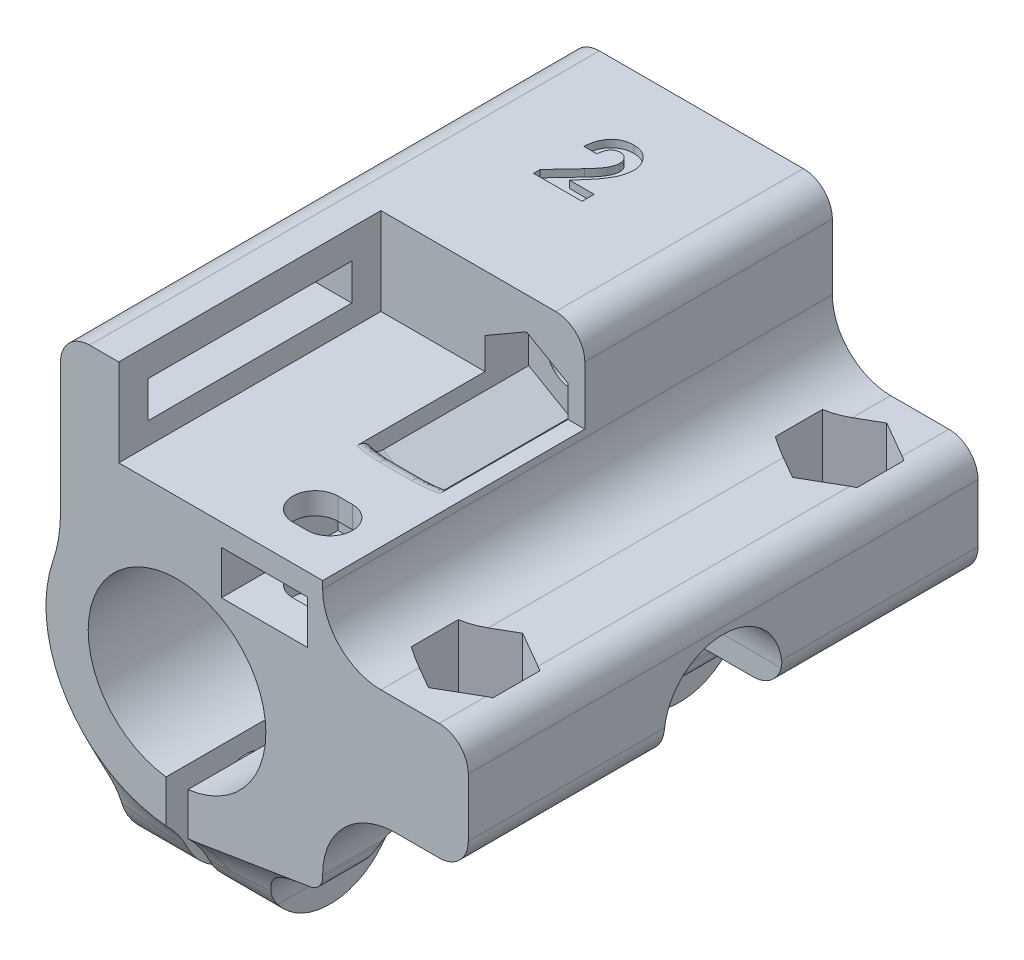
SolidWorks part; units mm, degrees
ref_plane "Спереди" through (0, 0, 0) normal (0, 0, 1) x (1, 0, 0)
ref_plane "Сверху" through (0, 0, 0) normal (0, 1, 0) x (1, 0, 0)
ref_plane "Справа" through (0, 0, 0) normal (1, 0, 0) x (0, 0, -1)
sketch "Эскиз1" plane through (0, 0, 0) normal (0, 0, 1) x (1, 0, 0)
  line L0 (0, 0) -> (0, 21.6321) construction
  line L1 (0, 0) -> (26.3176, 0) construction
  line L2 (10, -1.5) -> (10, -7.5)
  line L3 (-8, 15) -> (-8, 6.0828)
  line L4 (-6, 17) -> (8, 17)
  line L5 (10, 15) -> (10, 6.5)
  line L6 (10, -7.5) -> (1.4365, -8.8846)
  line L8 (10, 6.5) -> (18, 6.5)
  line L9 (20, 4.5) -> (20, 0.5)
  line L10 (18, -1.5) -> (10, -1.5)
  arc A0 (-8.5263, 2.8813) -> (-8, 6.0828) centre (-18, 6.0828) ccw
  arc A1 (-8.5263, 2.8813) -> (1.4365, -8.8846) centre (0, 0) ccw
  arc A2 (20, 0.5) -> (18, -1.5) centre (18, 0.5) cw
  arc A3 (18, 6.5) -> (20, 4.5) centre (18, 4.5) cw
  arc A6 (8, 17) -> (10, 15) centre (8, 15) cw
  arc A7 (-6, 17) -> (-8, 15) centre (-6, 15) ccw
  point P16 (20, 6.5)
  point P30 (20, -1.5)
  dimension "D2" = 1.5
  dimension "D4" = 2
  dimension "D5" = 6
  dimension "D6" = 9
  dimension "D12" = 2
  dimension "D13" = 10
  dimension "D3" = 20
  dimension "D7" = 17
  dimension "D8" = 8
  dimension "D9" = 10
  dimension "D14" = 8
extrude "Бобышка-Вытянуть1" add sketch "Эскиз1" along normal blind 35
fillet "Скругление21" radius 5 1 edges at (10, -1.5, 17.5)
fillet "Скругление24" radius 4 1 edges at (10, 6.5, 17.5)
sketch "Эскиз2" plane through (20, 0, 0) normal (1, 0, 0) x (0, 0, -1)
  line L1 (-35, 0.5) -> (-35, -1.5) construction
  line L3 (-21.55, 0) -> (-21.55, -7.076)
  line L5 (0, 0) -> (-35, 0) construction
  line L8 (-21.55, -7.076) -> (-13.45, -7.076)
  line L9 (-13.45, -7.076) -> (-13.45, 0)
  arc A0 (-13.45, 0) -> (-21.55, 0) centre (-17.5, 0) ccw
  dimension "D1" = 8.1
extrude "Вырез-Вытянуть1" cut sketch "Эскиз2" against normal blind 10
sketch "Эскиз3" plane through (0, 0, 35) normal (0, 0, 1) x (1, 0, 0)
  line L0 (10, 15) -> (10, 11)
  line L3 (10, 11) -> (-4, 11)
  line L4 (-4, 17) -> (-4, 11)
  line L5 (8, 17) -> (-6, 17) construction
  line L6 (-4, 17) -> (8, 17)
  line L7 (10, 10.5) -> (10, 15) construction
  line L10 (0, 0) -> (0, 11.8) construction
  arc A1 (10, 15) -> (8, 17) centre (8, 15) ccw construction
  arc A2 (10, 15) -> (8, 17) centre (8, 15) ccw
  dimension "D1" = 14
  dimension "D3" = 11
extrude "Вырез-Вытянуть2" cut sketch "Эскиз3" against normal blind 18
sketch "Эскиз5" plane through (0, 0, 0) normal (0, 0, -1) x (-1, 0, 0)
  line L0 (0, 0) -> (0, 21.6564) construction
  line L1 (-7.2, 15.7) -> (3.6, 15.7)
  line L2 (-8.2, 14.7) -> (-8.2, 8.3)
  line L3 (-7.2, 7.3) -> (3.6, 7.3)
  line L4 (4.6, 14.7) -> (4.6, 8.3)
  line L6 (-8.2, 11.5) -> (4.6, 11.5) construction
  arc A0 (3.6, 15.7) -> (4.6, 14.7) centre (3.6, 14.7) cw
  arc A1 (3.6, 7.3) -> (4.6, 8.3) centre (3.6, 8.3) ccw
  arc A2 (-8.2, 8.3) -> (-7.2, 7.3) centre (-7.2, 8.3) ccw
  arc A3 (-7.2, 15.7) -> (-8.2, 14.7) centre (-7.2, 14.7) ccw
  point P6 (4.6, 15.7)
  point P13 (-8.2, 15.7)
  dimension "D2" = 1
  dimension "D1" = 12.8
  dimension "D3" = 8.4
  dimension "D4" = 11.5
  dimension "D5" = 8.2
extrude "Вырез-Вытянуть4" cut sketch "Эскиз5" against normal blind 12
fillet "Скругление22" radius 1 1 edges at (10, -7.5, 17.5)
ref_plane "Плоскость2" [suppressed] through (0, 0, 25) normal (0, 0, 1) x (1, 0, 0)
sketch "Эскиз6" plane through (0, 0, 25) normal (0, 0, -1) x (-1, 0, 0)
  line L0 (-7, 11.5) -> (4.6, 11.5) construction
  line L2 (4.6, 8.3) -> (4.6, 14.7) construction
  line L3 (0, 0) -> (0, 20.3496) construction
  circle A0 centre (-6, 11.5) radius 1.55
  dimension "D1" = 3.1
  dimension "D2" = 6
extrude "Вырез-Вытянуть5" cut sketch "Эскиз6" along normal through all
sketch "Эскиз7" plane through (0, 0, 25) normal (0, 0, 1) x (1, 0, 0)
  line L1 (6, 8.2091) -> (8.85, 9.8546)
  line L2 (8.85, 9.8546) -> (8.85, 13.1454)
  line L3 (8.85, 13.1454) -> (6, 14.7909)
  line L4 (6, 14.7909) -> (3.15, 13.1454)
  line L5 (3.15, 13.1454) -> (3.15, 9.8546)
  line L6 (3.15, 9.8546) -> (6, 8.2091)
  circle A0 centre (6, 11.5) radius 2.85 construction
  dimension "D1" = 5.7
extrude "Вырез-Вытянуть6" cut sketch "Эскиз7" against normal blind 11
sketch "Эскиз9" plane through (0, 17, 0) normal (0, 1, 0) x (1, 0, 0)
  line L0 (-6, -17.5) -> (20, -17.5) construction
  line L1 (8, 0) -> (-6, 0) construction
  line L3 (0, 0) -> (0, -35) construction
  line L4 (-4, -35) -> (-6, -35) construction
  circle A0 centre (15.5, -5) radius 1.55
  circle A1 centre (15.5, -30) radius 1.55
  dimension "D1" = 3.1
  dimension "D3" = 15.5
  dimension "D2" = 25
  dimension "D4" = 17.5
extrude "Вырез-Вытянуть8" cut sketch "Эскиз9" against normal through all
sketch "Эскиз10" plane through (0, 17, 0) normal (0, -1, 0) x (1, 0, 0)
  line L0 (-9, 17.5) -> (23.6847, 17.5) construction
  line L1 (12.7, 28.3834) -> (15.5, 26.7668)
  line L2 (15.5, 26.7668) -> (18.3, 28.3834)
  line L3 (18.3, 28.3834) -> (18.3, 31.6166)
  line L4 (18.3, 31.6166) -> (15.5, 33.2332)
  line L5 (15.5, 33.2332) -> (12.7, 31.6166)
  line L6 (12.7, 31.6166) -> (12.7, 28.3834)
  line L7 (-9, 35) -> (-9, 0) construction
  line L8 (12.7, 3.3834) -> (12.7, 6.6166)
  line L9 (15.5, 1.7668) -> (12.7, 3.3834)
  line L10 (18.3, 3.3834) -> (15.5, 1.7668)
  line L11 (18.3, 6.6166) -> (18.3, 3.3834)
  line L12 (15.5, 8.2332) -> (18.3, 6.6166)
  line L13 (12.7, 6.6166) -> (15.5, 8.2332)
  circle A0 centre (15.5, 30) radius 2.8 construction
  circle A1 centre (15.5, 5) radius 2.8 construction
  dimension "D1" = 5.6
extrude "Вырез-Вытянуть9" cut sketch "Эскиз10" along normal blind 15
sketch "Эскиз13" plane through (0, 0, 0) normal (0, 0, -1) x (-1, 0, 0)
  circle A0 centre (-6, 11.5) radius 2.85
  dimension "D1" = 5.7
extrude "Вырез-Вытянуть10" cut sketch "Эскиз13" against normal up to surface (12 mm away)
fillet "Скругление3" radius 1 2 edges at (8.2, 13.3118, 6) (8.2, 9.6882, 6)
sketch "Эскиз16" plane through (0, 0, 0) normal (1, 0, 0) x (0, 0, -1)
  line L0 (0, 0) -> (-35, 0) construction
  line L1 (-17.5, 0) -> (-17.5, 5.7469) construction
  line L2 (-35, -9) -> (0, -9) construction
  line L4 (-35, 0.5) -> (-35, -1.5) construction
  circle A0 centre (-29.5, -9) radius 1.55 construction
  circle A1 centre (-29.5, -9) radius 4.5
  circle A2 centre (-5.5, -9) radius 4.5
  circle A3 centre (-17.5, 0) radius 4.05 construction
  dimension "D1" = 3.1
  dimension "D2" = 24
  dimension "D3" = 9
extrude "Бобышка-Вытянуть4" add sketch "Эскиз16" along normal mid plane 10
fillet "Скругление7" radius 7 4 edges at (-2.517, -8.6409, 9.9856) (-2.973, -8.4948, 25.0284) (3.2234, -8.5957, 25.0182) (3.2234, -8.5957, 9.9818)
fillet "Скругление9" radius 7 4 edges at (-1.5846, -8.8594, 33.9978) (-2.973, -8.4948, 1.0284) (3.2234, -8.5957, 1.0182) (3.2234, -8.5957, 33.9818)
fillet "Скругление11" radius 5 2 edges at (-5, -7.4833, 26.9178) (-5, -7.4833, 8.0822)
fillet "Скругление23" radius 4 2 edges at (5, -8.3084, 7.5868) (5, -8.3084, 27.4132)
sketch "Эскиз15" plane through (0, 0, 35) normal (0, 0, 1) x (1, 0, 0)
  circle A0 centre (0, 0) radius 6.1
  dimension "D1" = 12.2
extrude "Вырез-Вытянуть11" cut sketch "Эскиз15" against normal through all
sketch "Эскиз18" plane through (0, 0, 35) normal (0, 0, 1) x (1, 0, 0)
  line L0 (-5, -13.5) -> (5, -13.5) construction
  line L1 (-0.75, 0) -> (0.75, 0)
  line L2 (-0.75, 0) -> (-0.75, -13.5)
  line L3 (-0.75, -13.5) -> (0.75, -13.5)
  line L4 (0.75, 0) -> (0.75, -13.5)
  point P6 (0, 0)
  dimension "D1" = 1.5
extrude "Вырез-Вытянуть13" cut sketch "Эскиз18" against normal through all
ref_plane "Плоскость1" through (-10, 0, 0) normal (1, 0, 0) x (0, 0, -1)
sketch "Эскиз17" plane through (20, 0, 0) normal (1, 0, 0) x (0, 0, -1)
  line L0 (-17.5, -8.9687) -> (-17.5, 18.0703) construction
  line L1 (-20.3334, -8.9687) -> (-14.6666, -8.9687) construction
  circle A0 centre (-29.5, -9) radius 1.575
  circle A1 centre (-5.5, -9) radius 1.575
  dimension "D1" = 3.15
extrude "Вырез-Вытянуть12" cut sketch "Эскиз17" against normal through all
sketch "Эскиз19" plane through (-10, 0, 0) normal (1, 0, 0) x (0, 0, -1)
  line L0 (-17.5, -8.9687) -> (-17.5, 18.2144) construction
  line L1 (-32.7332, -9) -> (-31.1166, -11.8)
  line L2 (-31.1166, -11.8) -> (-27.8834, -11.8)
  line L3 (-27.8834, -11.8) -> (-26.2668, -9)
  line L4 (-26.2668, -9) -> (-27.8834, -6.2)
  line L5 (-27.8834, -6.2) -> (-31.1166, -6.2)
  line L6 (-31.1166, -6.2) -> (-32.7332, -9)
  line L7 (-14.6666, -8.9687) -> (-20.3334, -8.9687) construction
  line L8 (-3.8834, -6.2) -> (-2.2668, -9)
  line L9 (-7.1166, -6.2) -> (-3.8834, -6.2)
  line L10 (-8.7332, -9) -> (-7.1166, -6.2)
  line L11 (-7.1166, -11.8) -> (-8.7332, -9)
  line L12 (-3.8834, -11.8) -> (-7.1166, -11.8)
  line L13 (-2.2668, -9) -> (-3.8834, -11.8)
  circle A0 centre (-29.5, -9) radius 2.8 construction
  circle A1 centre (-5.5, -9) radius 2.8 construction
  dimension "D1" = 5.6
extrude "Вырез-Вытянуть14" cut sketch "Эскиз19" along normal blind 7
sketch "Эскиз24" plane through (20, 0, 0) normal (1, 0, 0) x (0, 0, -1)
  circle A0 centre (-29.5, -9) radius 2.85
  circle A1 centre (-5.5, -9) radius 2.85
  dimension "D1" = 5.7
extrude "Вырез-Вытянуть18" cut sketch "Эскиз24" against normal blind 16
sketch "Эскиз27" plane through (-4, 0, 0) normal (1, 0, 0) x (0, 0, -1)
  line L0 (-35, 17) -> (-35, 11) construction
  line L1 (-33, 15) -> (-19, 15)
  line L2 (-33, 15) -> (-33, 12.5)
  line L3 (-33, 12.5) -> (-19, 12.5)
  line L4 (-19, 15) -> (-19, 12.5)
  line L5 (-17, 17) -> (-17, 11) construction
  line L6 (-17, 17) -> (-35, 17) construction
  dimension "D1" = 2
  dimension "D2" = 2
  dimension "D3" = 2
  dimension "D4" = 2.5
sketch "Эскиз28" plane through (0, 0, 35) normal (0, 0, 1) x (1, 0, 0)
  line L0 (6, 11.5) -> (6, -14.6324) construction
  line L1 (-4, 11) -> (10, 11) construction
  line L2 (3.05, 9.5) -> (8.95, 9.5)
  line L3 (3.05, 9.5) -> (3.05, 6.5)
  line L4 (3.05, 6.5) -> (8.95, 6.5)
  line L5 (8.95, 9.5) -> (8.95, 6.5)
  point P7 (6, 9.5)
  dimension "D1" = 5.9
  dimension "D2" = 3
  dimension "D3" = 1.5
extrude "Вырез-Вытянуть20" cut sketch "Эскиз28" against normal blind 8
sketch "Эскиз29" plane through (0, 11, 0) normal (0, 1, 0) x (1, 0, 0)
  line L0 (6, -17) -> (6, -37.7365) construction
  line L1 (6, -14) -> (6, -25) construction
  line L2 (8, -17) -> (-4, -17) construction
  line L4 (5.5, -31) -> (6.5, -31) construction
  line L5 (5.5, -29.45) -> (6.5, -29.45)
  line L6 (5.5, -32.55) -> (6.5, -32.55)
  line L7 (-4, -35) -> (10, -35) construction
  arc A1 (5.5, -29.45) -> (5.5, -32.55) centre (5.5, -31) ccw
  arc A2 (6.5, -32.55) -> (6.5, -29.45) centre (6.5, -31) ccw
  point P12 (6, -31)
  dimension "D1" = 4
  dimension "D2" = 1.55
  dimension "D3" = 1
extrude "Вырез-Вытянуть21" cut sketch "Эскиз29" against normal blind 6
extrude "Вырез-Вытянуть22" cut sketch "Эскиз27" against normal blind 3
fillet "Скругление17" radius 1 2 edges at (7.425, 9.0318, 25) (4.575, 9.0318, 25)
fillet "Скругление18" radius 1 3 edges at (3.158, 11, 25) (8.842, 11, 25) (6, 11, 25)
sketch "Эскиз30" plane through (0, 17, 0) normal (0, 1, 0) x (1, 0, 0)
  text T0 "<b>2</b>" font "Century Gothic" height 5
extrude "Вырез-Вытянуть23" cut sketch "Эскиз30" against normal blind 0.5
